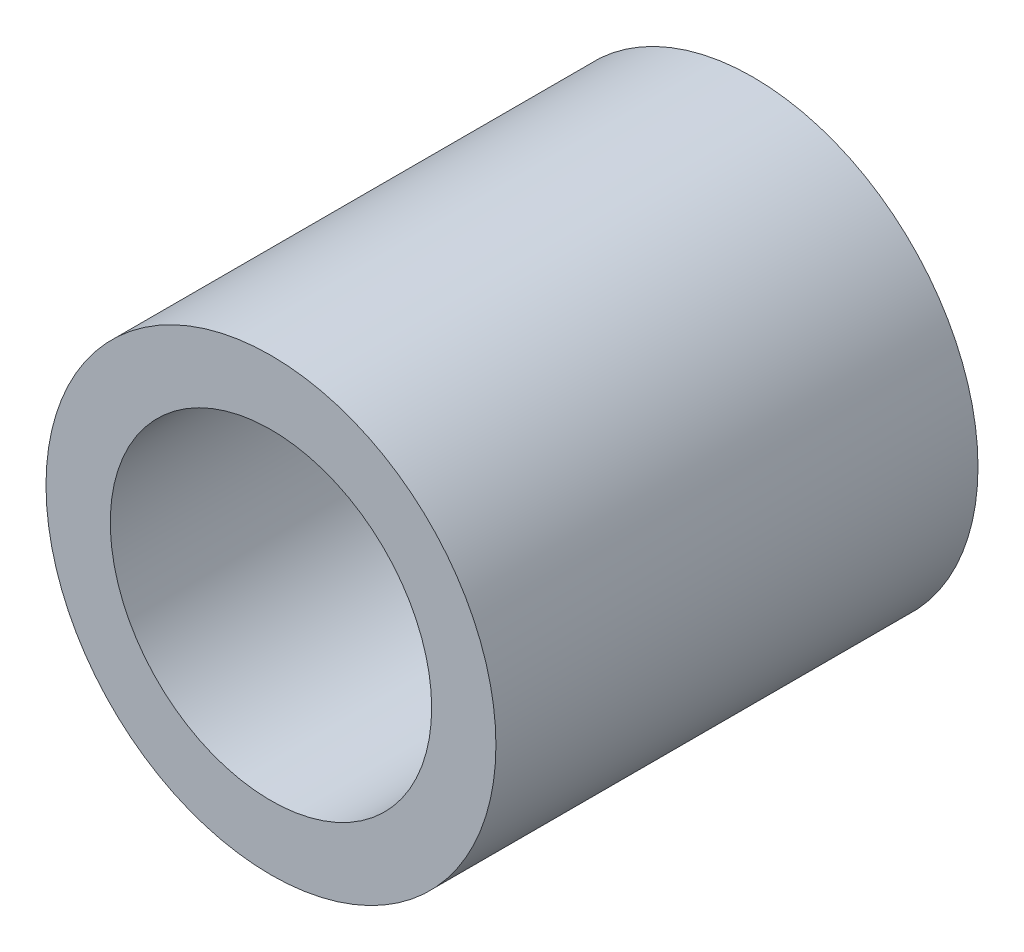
SolidWorks part; units mm, degrees
ref_plane "Plan de face" through (0, 0, 0) normal (0, 0, 1) x (1, 0, 0)
ref_plane "Plan de dessus" through (0, 0, 0) normal (0, 1, 0) x (1, 0, 0)
ref_plane "Plan de droite" through (0, 0, 0) normal (1, 0, 0) x (0, 0, -1)
sketch "Esquisse1" plane through (0, 0, 0) normal (0, 0, 1) x (1, 0, 0)
  circle A0 centre (0, 0) radius 5
  circle A1 centre (0, 0) radius 7
  dimension "D1" = 10
  dimension "D2" = 14
extrude "Extrusion1" add sketch "Esquisse1" along normal blind 15
